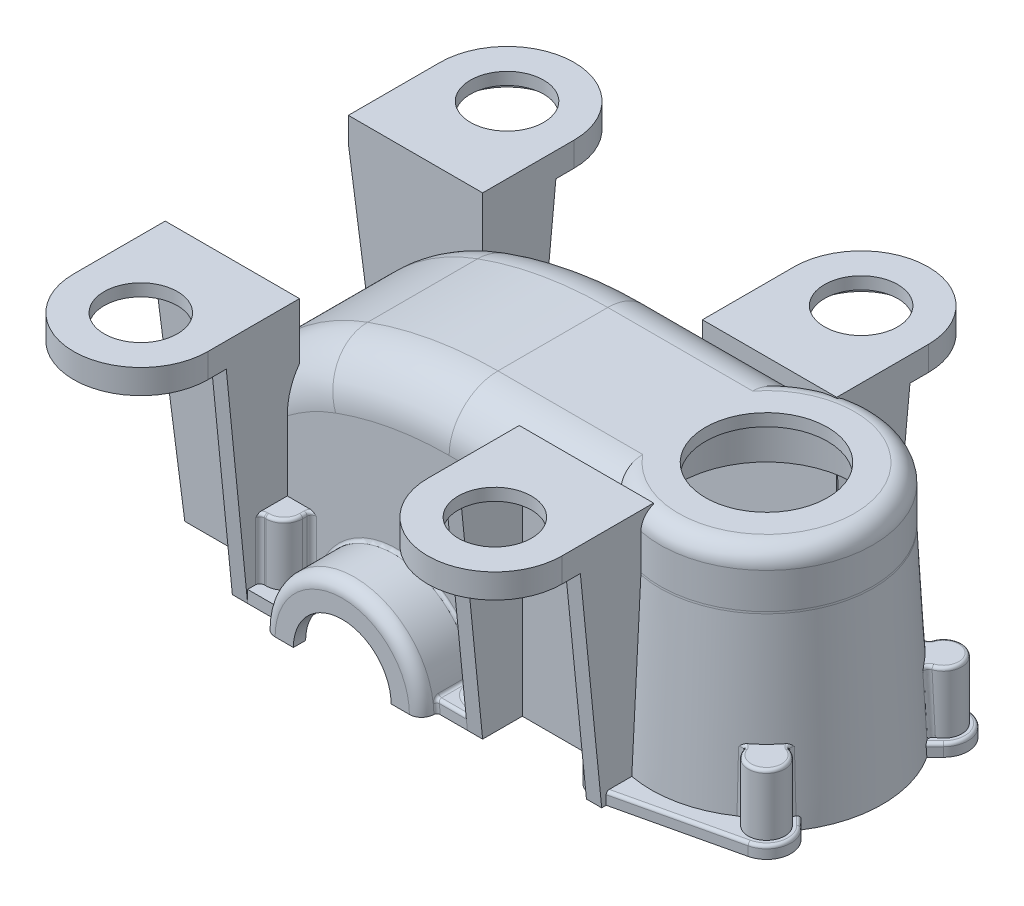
SolidWorks part; units mm, degrees
ref_plane "Face" through (0, 0, 0) normal (0, 0, 1) x (1, 0, 0)
ref_plane "Dessus" through (0, 0, 0) normal (0, 1, 0) x (1, 0, 0)
ref_plane "Droite" through (0, 0, 0) normal (1, 0, 0) x (0, 0, -1)
sketch "Esquisse2" plane through (0, 0, 0) normal (0, 0, 1) x (1, 0, 0)
  line L0 (-37.5, 0) -> (43, 0)
  line L1 (43, 39) -> (8.5069, 39)
  line L2 (43, 39) -> (43, 0)
  line L3 (-12.8258, 35.2385) -> (8.5069, -23.3726) construction
  line L4 (8.5069, -23.3726) -> (8.5069, 80.3825) construction
  arc A0 (-12.8258, 35.2385) -> (-37.5, 0) centre (0, 0) ccw
  arc A1 (8.5069, 39) -> (-12.8258, 35.2385) centre (8.5069, -23.3726) ccw
  dimension "D1" = 75
  dimension "D4" = 20
  dimension "D2" = 39
  dimension "D3" = 43
extrude "Extrusion1" add sketch "Esquisse2" along normal mid plane 34
sketch "Esquisse3" plane through (0, 0, 0) normal (0, -1, 0) x (1, 0, 0)
  circle A0 centre (43.5, 0) radius 19
  dimension "D2" = 38
  dimension "D1" = 43.5
extrude "Extrusion2" add sketch "Esquisse3" against normal blind 30 draft 3
sketch "Esquisse5" plane through (0, 30, 0) normal (0, 1, 0) x (-1, 0, 0)
  circle A0 centre (-43.5, 0) radius 17.4278
  arc A1 (-39.6624, 17) -> (-39.6624, -17) centre (-43.5, 0) ccw construction
extrude "Extrusion3" add sketch "Esquisse5" along normal up to surface (9 mm away)
fillet "Congé3" radius 6
fillet "Congé6" radius 8
fillet "Congé11" radius 3
shell "Coque1" thickness 2
sketch "Esquisse6" plane through (0, 0, 0) normal (0, 0, 1) x (1, 0, 0)
  circle A0 centre (0, 0) radius 8
  dimension "D1" = 16
extrude "Enlèv. mat.-Extru.2" cut sketch "Esquisse6" against normal mid plane 73
sketch "Esquisse7" plane through (0, 0, 0) normal (0, -1, 0) x (1, 0, 0)
  line L0 (0, 27.9619) -> (0, -31.7626) construction
  line L1 (11, -17) -> (11, -24)
  line L2 (8, -17) -> (35.0147, -17) construction
  line L3 (11, -24) -> (8, -24)
  line L4 (8, -24) -> (8, -26)
  line L5 (8, -26) -> (13, -26)
  line L6 (13, -26) -> (13, -17)
  line L7 (13, -17) -> (11, -17)
  dimension "D1" = 2
  dimension "D2" = 2
  dimension "D3" = 16
  dimension "D4" = 22
  dimension "D5" = 7
revolve "Révolution1" add sketch "Esquisse7" angle 180 about L0
sketch "Esquisse8" plane through (0, 0, 0) normal (0, -1, 0) x (1, 0, 0)
  line L0 (13, -17) -> (35.0147, -17) construction
  line L2 (-29.5, -15) -> (-8, -15) construction
  line L3 (-11.6965, -23.5) -> (-21.9379, -23.5)
  line L4 (-11.6965, -23.5) -> (-11.6965, -15)
  line L5 (-11.6965, -15) -> (-21.9379, -15)
  line L6 (-21.9379, -23.5) -> (-21.9379, -15)
  line L9 (12.1379, -23.5) -> (12.1379, -15)
  line L11 (12.1379, -23.5) -> (35.9143, -23.5)
  line L12 (37.718, -23.294) -> (58.8975, -18.3927)
  line L13 (43.5, 0) -> (63.1523, -19.6523) construction
  line L14 (0, 0) -> (63.332, 0) construction
  line L15 (60.8241, -11.6673) -> (58.0008, -8.844)
  line L17 (12.1379, -15) -> (35.5234, -15)
  arc A3 (58.8975, -18.3927) -> (60.8241, -11.6673) centre (57.9957, -14.4957) ccw
  arc A4 (36.3361, -15.4002) -> (58.0008, -8.844) centre (43.5, 0) ccw
  arc A5 (35.9143, -23.5) -> (37.718, -23.294) centre (35.9143, -15.5) ccw
  spline S2 degree 3 poles (34.5478, -14.7611) (34.8667, -14.8016) (35.1754, -14.8757) (35.773, -15.0886) (36.064, -15.229) (36.3361, -15.4002) knots 0 0 0 0 0.5 0.5 1 1 1 1 only from (35.5234, -15) to (36.3361, -15.4002)
  dimension "D4" = 45
  dimension "D6" = 8
  dimension "D1" = 8
  dimension "D2" = 6.5
  dimension "D5" = 20.5
extrude "Extrusion6" add sketch "Esquisse8" against normal blind 2
mirror "Symétrie2" about plane through (0, 0, 0) normal (0, 0, 1)
fillet "Congé7" radius 0.5
fillet "Congé8" radius 2
ref_plane "Plan1" through (0, 0, 4) normal (0, 0, 1) x (1, 0, 0)
sketch "Esquisse14" plane through (0, 0, 0) normal (0, -1, 0) x (1, 0, 0)
  line L0 (-29.8126, -18.5) -> (26.6786, -18.5) construction
  line L1 (43.5, 0) -> (37.1652, -19.4967) construction
  line L2 (43.5, 0) -> (43.5, -40.4163) construction
  circle A0 centre (-17, -18.5) radius 1.5
  circle A1 centre (17, -18.5) radius 1.5
  circle A2 centre (57.9957, -14.4957) radius 1.5
  circle A3 centre (37.1652, -19.4967) radius 1.5
  arc A4 (36.3361, -15.4002) -> (58.0008, -8.844) centre (43.5, 0) ccw construction
  dimension "D2" = 3
  dimension "D3" = 3
  dimension "D6" = 3
  dimension "D7" = 3
  dimension "D1" = 18.5
  dimension "D4" = 17
  dimension "D5" = 34
  dimension "D8" = 20.5
  dimension "D9" = 18
sketch "Esquisse19" plane through (0, 0, 0) normal (0, -1, 0) x (1, 0, 0)
  line L0 (-29, 26.0223) -> (-29, -25.4696) construction
  line L1 (-18, -30) -> (-18, -15)
  line L2 (-40, -30) -> (-40, -15)
  line L3 (-40, -15) -> (-18, -15)
  line L4 (-29.5, -15) -> (-8, -15) construction
  line L5 (29, -3.6008) -> (29, -49.6833) construction
  line L6 (-29, -30) -> (51.6533, -30) construction
  line L7 (18, -30) -> (18, -15)
  line L8 (8, -15) -> (35.5234, -15) construction
  line L9 (18, -15) -> (40, -15)
  line L10 (40, -30) -> (40, -15)
  arc A0 (-40, -30) -> (-18, -30) centre (-29, -30) ccw
  arc A1 (18, -30) -> (40, -30) centre (29, -30) ccw
  dimension "D2" = 22
  dimension "D5" = 22
  dimension "D1" = 29
  dimension "D3" = 30
  dimension "D4" = 29
extrude "Extrusion12" add sketch "Esquisse19" against normal blind 39
sketch "Esquisse20" plane through (0, 0, 0) normal (0, -1, 0) x (1, 0, 0)
  line L0 (-20.5, -30) -> (-20.5, -17)
  line L1 (-20.5, -17) -> (-37.5, -17)
  line L2 (-37.5, -17) -> (-37.5, -30)
  line L3 (-29.5, -15) -> (-8, -15) construction
  line L4 (20.5, -30) -> (20.5, -17)
  line L5 (20.5, -17) -> (37.5, -17)
  line L6 (37.5, -17) -> (37.5, -30)
  arc A2 (-37.5, -30) -> (-20.5, -30) centre (-29, -30) ccw
  arc A3 (-37.5, -30) -> (-20.5, -30) centre (-29, -30) ccw
  arc A5 (20.5, -30) -> (37.5, -30) centre (29, -30) ccw
  arc A6 (20.5, -30) -> (37.5, -30) centre (29, -30) ccw
  dimension "D2" = 2
  dimension "D1" = 2.5
  dimension "D3" = 2.5
extrude "Enlèv. mat.-Extru.5" cut sketch "Esquisse20" against normal blind 37
sketch "Esquisse21" plane through (0, 0, 0) normal (0, -1, 0) x (1, 0, 0)
  line L0 (-13.2324, -27) -> (-27.5081, -27)
  line L1 (-13.2324, -27) -> (-13.2324, -49.6301)
  line L2 (-13.2324, -49.6301) -> (-43.0074, -49.6301)
  line L3 (-43.0074, -49.6301) -> (-43.0074, -17)
  line L4 (-43.0074, -17) -> (-27.5081, -17)
  line L5 (-27.5081, -17) -> (-27.5081, -27)
  line L6 (-20.5, -17) -> (-37.5, -17) construction
  arc A0 (-37.5, -30) -> (-20.5, -30) centre (-29, -30) ccw construction
  dimension "D1" = 3
extrude "Enlèv. mat.-Extru.6" cut sketch "Esquisse21" against normal blind 35
sketch "Esquisse22" plane through (-20.5, 0, 0) normal (-1, 0, 0) x (0, 0, 1)
  line L0 (-27, 35) -> (-23.5, 0)
  line L2 (-27, 0) -> (-23.5, 0) construction
  line L3 (-27, 0) -> (-23.5, 0)
  line L5 (-27, 35) -> (-27, 0) construction
  line L6 (-27, 35) -> (-27, 0)
extrude "Enlèv. mat.-Extru.7" cut sketch "Esquisse22" against normal blind 2.5
sketch "Esquisse23" plane through (0, 0, -15) normal (0, 0, 1) x (1, 0, 0)
  line L0 (-34.7915, 0) -> (-40, 0) construction
  line L1 (-34.7915, 0) -> (-40, 0)
  line L2 (-40, 0) -> (-40, 35) construction
  line L3 (-40, 0) -> (-40, 35)
  line L4 (-34.7915, 0) -> (-40, 35)
extrude "Enlèv. mat.-Extru.8" cut sketch "Esquisse23" against normal blind 2
sketch "Esquisse24" plane through (0, 0, 0) normal (0, -1, 0) x (1, 0, 0)
  line L0 (-18, -23.5) -> (-18, -17) construction
  line L1 (-30.0108, -18.5) -> (5.4156, -18.5) construction
  line L2 (-29.8126, -18.5) -> (26.6786, -18.5) construction
  line L3 (-18, -21.5) -> (-18, -17)
  line L5 (-11, -17) -> (-8, -17) construction
  line L6 (-18, -17) -> (-14, -17)
  line L7 (-14, -18.5) -> (-14, -17)
  line L8 (-17, -21.5) -> (-18, -21.5)
  arc A0 (-17, -21.5) -> (-14, -18.5) centre (-17, -18.5) ccw
  circle A1 centre (-17, -18.5) radius 1.5 construction
  dimension "D1" = 6
extrude "Extrusion13" add sketch "Esquisse24" against normal blind 12
sketch "Esquisse26" plane through (18, 0, 0) normal (-1, 0, 0) x (0, 0, 1)
  line L0 (-23.5, 0) -> (-27, 35) construction
  line L1 (-23.5, 0) -> (-27, 35)
  line L2 (-27, 35) -> (-48.5375, 35)
  line L3 (-48.5375, 35) -> (-48.5375, 0)
  line L4 (-48.5375, 0) -> (-23.5, 0)
extrude "Enlèv. mat.-Extru.10" cut sketch "Esquisse26" against normal blind 30
sketch "Esquisse27" plane through (0, 0, 0) normal (0, -1, 0) x (1, 0, 0)
  line L0 (37.5, -17) -> (34.1652, -17)
  line L2 (37.5, -17) -> (37.5, -22.4967)
  line L3 (37.1652, -22.4967) -> (37.5, -22.4967)
  line L4 (34.1652, -19.4967) -> (34.1652, -17)
  circle A0 centre (17, -18.5) radius 3
  circle A1 centre (57.9957, -14.4957) radius 3
  arc A2 (34.1652, -19.4967) -> (37.1652, -22.4967) centre (37.1652, -19.4967) ccw
  dimension "D1" = 6
  dimension "D2" = 6
  dimension "D3" = 6
extrude "Extrusion14" add sketch "Esquisse27" against normal blind 12
extrude "Enlèv. mat.-Extru.9" cut sketch "Esquisse14" against normal blind 10
mirror "Symétrie3" about plane through (0, 0, 0) normal (0, 0, 1)
fillet "Congé9" radius 0.75
fillet "Congé10" radius 0.5
sketch "Esquisse28" plane through (0, 37, 0) normal (0, -1, 0) x (1, 0, 0)
  circle A0 centre (-29, 30) radius 6
  circle A1 centre (29, 30) radius 6
  circle A2 centre (29, -30) radius 6
  circle A3 centre (-29, -30) radius 6
  dimension "D1" = 12
  dimension "D2" = 12
  dimension "D3" = 12
  dimension "D4" = 12
extrude "Enlèv. mat.-Extru.11" cut sketch "Esquisse28" against normal blind 10
sketch "Esquisse29" plane through (0, 37, 0) normal (0, -1, 0) x (1, 0, 0)
  circle A0 centre (43.5, 0) radius 14.25
  circle A1 centre (43.5, 0) radius 15.75
  dimension "D1" = 28.5
  dimension "D2" = 1.5
extrude "Extrusion15" add sketch "Esquisse29" along normal blind 8
sketch "Esquisse30" plane through (0, 37, 0) normal (0, -1, 0) x (1, 0, 0)
  circle A0 centre (43.5, 0) radius 10
  dimension "D1" = 20
extrude "Enlèv. mat.-Extru.12" cut sketch "Esquisse30" against normal blind 8
ref_plane "Plan2" through (0, 0, 4) normal (0, 0, 1) x (1, 0, 0)
sketch "Esquisse31" plane through (0, 0, 4) normal (0, 0, 1) x (1, 0, 0)
  line L0 (29.0588, 37) -> (15.6214, 37)
  line L1 (20.5, 37) -> (37.5, 37) construction
  line L2 (8.5069, 37) -> (30.5747, 37) construction
  line L3 (15.6214, 37) -> (29.0588, 29.7637)
  line L4 (29.0588, 29.7637) -> (29.0588, 37)
extrude "Extrusion16" add sketch "Esquisse31" along normal blind 1.5
mirror "Symétrie4" about plane through (0, 0, 0) normal (0, 0, 1)
